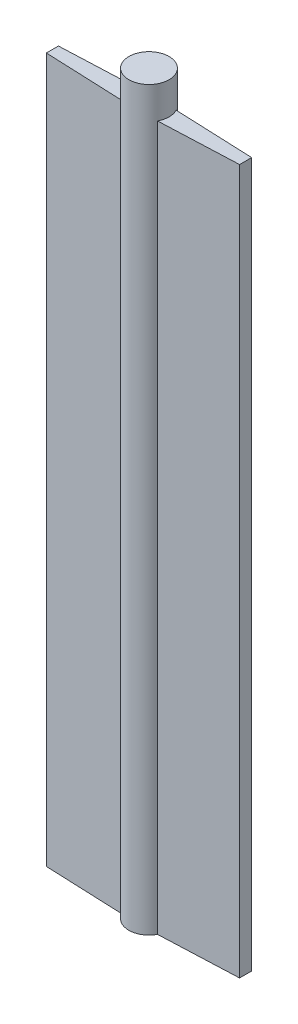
SolidWorks part; units mm, degrees
ref_plane "Front Plane" through (0, 0, 0) normal (0, 0, 1) x (1, 0, 0)
ref_plane "Top Plane" through (0, 0, 0) normal (0, 1, 0) x (1, 0, 0)
ref_plane "Right Plane" through (0, 0, 0) normal (1, 0, 0) x (0, 0, -1)
sketch "Sketch1" plane through (0, 0, 0) normal (0, 1, 0) x (1, 0, 0)
  line L0 (0, 3.175) -> (0, -3.175)
  line L3 (0, 3.175) -> (30.48, 1.905)
  line L4 (30.48, 1.905) -> (30.48, -1.905)
  line L5 (30.48, -1.905) -> (0, -3.175)
  line L6 (-30.48, -1.905) -> (0, -3.175)
  line L7 (-30.48, 1.905) -> (-30.48, -1.905)
  line L8 (0, 3.175) -> (-30.48, 1.905)
  circle A0 centre (0, 0) radius 6.35
  point P5 (30.48, 0)
  point P6 (0, 0)
  dimension "D1" = 12.7
  dimension "D2" = 6.35
  dimension "D3" = 3.81
  dimension "D4" = 30.48
extrude "Boss-Extrude1" add sketch "Sketch1" along normal blind 222.25 contours A0 L5 L4 L3 | A0 L8 L7 L6
sketch "Sketch2" plane through (0, 222.25, 0) normal (0, 1, 0) x (1, 0, 0)
  circle A0 centre (0, 0) radius 6.35
extrude "Boss-Extrude2" add sketch "Sketch2" along normal blind 10.16
sketch "Sketch3" plane through (0, 0, 0) normal (0, 0, 1) x (1, 0, 0)
  line L1 (-30.48, 0) -> (-15.24, 0)
  line L2 (-30.48, 0) -> (-30.48, 15.24)
  line L3 (-30.48, 15.24) -> (-15.24, 15.24)
  line L4 (-15.24, 0) -> (-15.24, 15.24)
  dimension "D1" = 15.24
  dimension "D2" = 15.24
extrude "Cut-Extrude1" [suppressed] cut sketch "Sketch3" against normal through all both and the other way through all
ref_plane "Plane1" through (0, 226.06, 0) normal (0, 1, 0) x (1, 0, 0)
sketch "Sketch4" plane through (0, 226.06, 0) normal (0, 1, 0) x (1, 0, 0)
  line L0 (5.3882, 5.3882) -> (-20.0118, 30.7882)
  line L2 (-30.7882, 20.0118) -> (-5.3882, -5.3882)
  arc A1 (-5.3882, -5.3882) -> (5.3882, 5.3882) centre (0, 0) ccw
  arc A2 (-20.0118, 30.7882) -> (-30.7882, 20.0118) centre (-25.4, 25.4) ccw
  circle A4 centre (0, 0) radius 6.35 construction
  circle A5 centre (0, 0) radius 6.35
  circle A6 centre (-25.4, 25.4) radius 1.5875
  dimension "D2" = 7.62
  dimension "D6" = 3.175
  dimension "D3" = 15.24
  dimension "D4" = 25.4
  dimension "D5" = 25.4
extrude "Boss-Extrude3" [suppressed] add sketch "Sketch4" along normal blind 3.175
